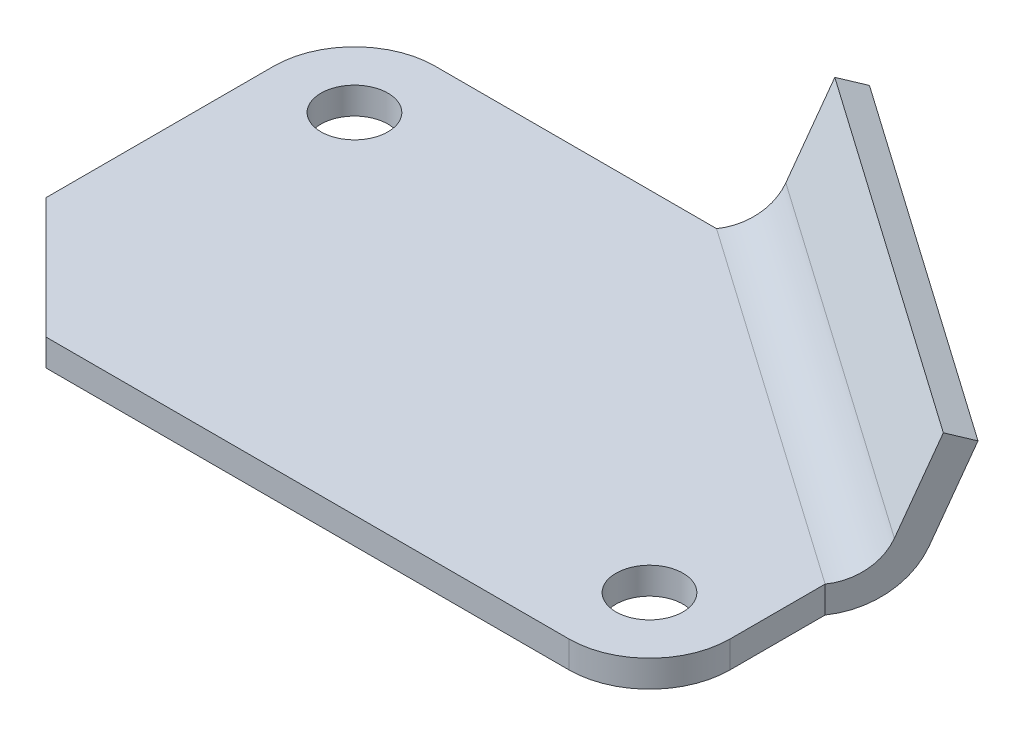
SolidWorks part; units mm, degrees
ref_plane "Front Plane" through (0, 0, 0) normal (0, 0, 1) x (1, 0, 0)
ref_plane "Top Plane" through (0, 0, 0) normal (0, 1, 0) x (1, 0, 0)
ref_plane "Right Plane" through (0, 0, 0) normal (1, 0, 0) x (0, 0, -1)
sketch "Sketch2" plane through (0, 0, 0) normal (0, 1, 0) x (1, 0, 0)
  line L1 (6, -52) -> (84, -52)
  line L2 (-12, -34) -> (-12, 0)
  line L3 (0, 12) -> (42, 12)
  line L4 (96, -40) -> (96, -25.8112)
  line L6 (-12, -34) -> (6, -52)
  line L7 (42, 12) -> (96, -25.8112)
  line L8 (42, 12) -> (49.4944, 12) construction
  circle A0 centre (0, 0) radius 5
  circle A1 centre (84, -40) radius 5
  arc A2 (84, -52) -> (96, -40) centre (84, -40) ccw
  arc A3 (0, 12) -> (-12, 0) centre (0, 0) ccw
  point P0 (0, 0)
  dimension "D1" = 12
  dimension "D2" = 10
  dimension "D3" = 10
  dimension "D4" = 18
  dimension "D5" = 18
  dimension "D6" = 35
  dimension "D7" = 108
  dimension "D8" = 54
  dimension "D9" = 64
extrude "Boss-Extrude1" add sketch "Sketch2" against normal blind 4
ref_plane "Plane1" through (76.5443, 0, 53.5969) normal (0.8192, 0, 0.5736) x (0, 1, 0)
sketch "Sketch4" plane through (76.5443, 0, 53.5969) normal (0.8192, 0, 0.5736) x (0, 1, 0)
  line L0 (-4, -22.2973) -> (-4, -33.92) construction
  line L3 (-4, -22.2973) -> (-4, -33.92) construction
  line L4 (-4, -33.92) -> (0, -33.92) construction
  line L7 (-4, -33.92) -> (0, -33.92)
  line L8 (0, -22.2973) -> (0, -33.92) construction
  line L9 (5.0031, -41.3375) -> (17.9837, -46.582)
  line L10 (17.9837, -46.582) -> (16.4853, -50.2907)
  line L11 (16.4853, -50.2907) -> (3.5047, -45.0462)
  line L12 (0, -22.2973) -> (0, -33.92) construction
  arc A2 (0, -33.92) -> (5.0031, -41.3375) centre (8, -33.92) ccw
  arc A3 (-4, -33.92) -> (3.5047, -45.0462) centre (8, -33.92) ccw
  point P1 (0, -33.92)
  point P2 (0, 0)
  point P3 (-4, -33.92)
  point P4 (0, 0)
  point P5 (-4, -33.92)
  point P9 (0, -33.92)
  dimension "D1" = 112
  dimension "D2" = 12
  dimension "D6" = 14
  dimension "D3" = 8
  dimension "D4" = 4
  dimension "D5" = 14
extrude "Boss-Extrude2" add sketch "Sketch4" against normal up to vertex (65.9218 mm away)
